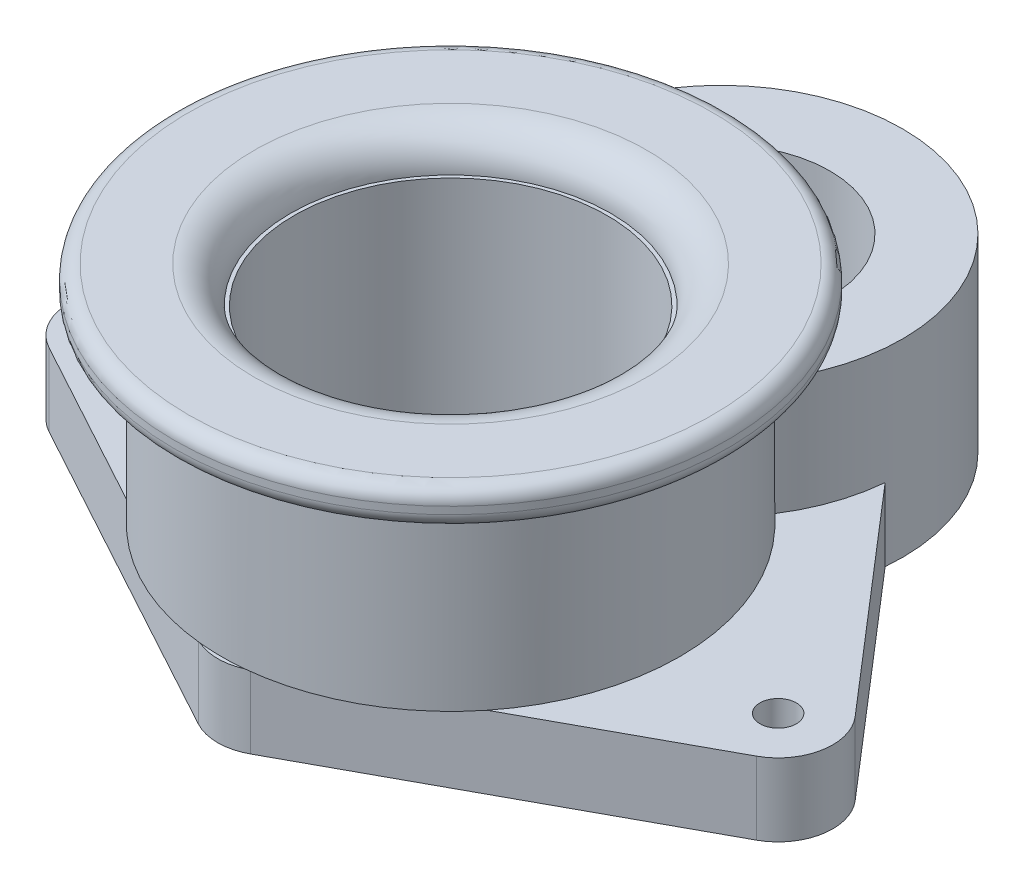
SolidWorks part; units mm, degrees
ref_plane "前视基准面" through (0, 0, 0) normal (0, 0, 1) x (1, 0, 0)
ref_plane "上视基准面" through (0, 0, 0) normal (0, 1, 0) x (1, 0, 0)
ref_plane "右视基准面" through (0, 0, 0) normal (1, 0, 0) x (0, 0, -1)
sketch "草图1" plane through (0, 0, 0) normal (0, 1, 0) x (1, 0, 0)
  circle A0 centre (0, 0) radius 100
  dimension "D1" = 200
extrude "凸台-拉伸1" add sketch "草图1" along normal blind 10
sketch "草图2" plane through (0, 10, 0) normal (0, 1, 0) x (1, 0, 0)
  circle A1 centre (-23.3644, 7.3724) radius 2.5
  circle A2 centre (23.3644, 7.3724) radius 2.5
  circle A3 centre (0, -24.5) radius 2.5
  dimension "D1" = 24.5
  dimension "D2" = 5
  dimension "D3" = 5
  dimension "D4" = 5
  dimension "D5" = 24.5
  dimension "D6" = 24.5
extrude "切除-拉伸1" cut sketch "草图2" against normal through all
sketch "草图6" plane through (0, 10, 0) normal (0, 1, 0) x (1, 0, 0)
  circle A0 centre (0, 0) radius 22
  circle A1 centre (0, 37.1) radius 15
  dimension "D1" = 30
  dimension "D2" = 37.1
sketch "草图7" plane through (0, 10, 0) normal (0, 1, 0) x (1, 0, 0)
  circle A0 centre (-45, 0) radius 2.5
  circle A1 centre (45, 0) radius 2.5
  dimension "D3" = 5
  dimension "D4" = 5
  dimension "D1" = 45
  dimension "D2" = 45
extrude "切除-拉伸2" cut sketch "草图7" against normal blind 10
extrude "切除-拉伸10" cut sketch "草图6" against normal through all contours A1
sketch "草图11" plane through (0, 10, 0) normal (0, 1, 0) x (1, 0, 0)
  circle A1 centre (0, 0) radius 21.5
  dimension "D1" = 43
extrude "切除-拉伸15" cut sketch "草图11" against normal through all
sketch "草图12" plane through (0, 10, 0) normal (0, 1, 0) x (1, 0, 0)
  circle A2 centre (0, 0) radius 31.5
  arc A3 (-20.9768, 23.4995) -> (20.9768, 23.4995) centre (0, 0) ccw
  circle A5 centre (0, 37.1) radius 25
  arc A8 (20.9768, 23.4995) -> (-20.9768, 23.4995) centre (0, 37.1) ccw
  dimension "D3" = 10
  dimension "D1" = 10
extrude "凸台-拉伸3" add sketch "草图12" along normal blind 16
sketch "草图13" plane through (0, 26, 0) normal (0, 1, 0) x (1, 0, 0)
  line L1 (-20.9768, 23.4995) -> (20.9768, 23.4995)
  arc A1 (-20.9768, 23.4995) -> (20.9768, 23.4995) centre (0, 0) ccw
extrude "凸台-拉伸4" add sketch "草图13" along normal blind 10
sketch "草图14" plane through (0, 36, 0) normal (0, 1, 0) x (1, 0, 0)
  circle A0 centre (0, 0) radius 21.5
  dimension "D1" = 43
extrude "切除-拉伸16" cut sketch "草图14" against normal through all
sketch "草图15" plane through (0, 26, 0) normal (0, 1, 0) x (1, 0, 0)
  circle A1 centre (0, 37.1) radius 15
  dimension "D1" = 30
extrude "切除-拉伸17" cut sketch "草图15" against normal through all
sketch "草图16" plane through (0, 0, 0) normal (0, -1, 0) x (1, 0, 0)
  line L4 (-48.5863, 6.587) -> (-3.5863, 31.087)
  line L5 (3.5863, 31.087) -> (48.5863, 6.587)
  line L6 (50.68, -4.8977) -> (24.8942, -34.8027)
  line L7 (-50.68, -4.8977) -> (-24.8942, -34.8027)
  arc A0 (3.5863, 31.087) -> (-3.5863, 31.087) centre (0, 24.5) ccw
  arc A1 (50.68, -4.8977) -> (48.5863, 6.587) centre (45, 0) ccw
  circle A4 centre (0, 0) radius 100
  arc A6 (-48.5863, 6.587) -> (-50.68, -4.8977) centre (-45, 0) ccw
  arc A7 (-24.8942, -34.8027) -> (24.8942, -34.8027) centre (0, -37.1) ccw
  dimension "D1" = 50
extrude "切除-拉伸18" cut sketch "草图16" against normal blind 10
sketch "草图17" plane through (0, 36, 0) normal (0, 1, 0) x (1, 0, 0)
  circle A0 centre (0, 0) radius 22
  circle A2 centre (0, 0) radius 38
extrude "凸台-拉伸6" add sketch "草图17" along normal blind 5
fillet "圆角1" radius 5 1 edges at (0, 41, 22)
fillet "圆角2" radius 2 1 edges at (0, 41, 38)
fillet "圆角3" radius 2 1 edges at (0, 36, 38)
fillet "圆角4" radius 1 1 edges at (0, 0, 21.5)
